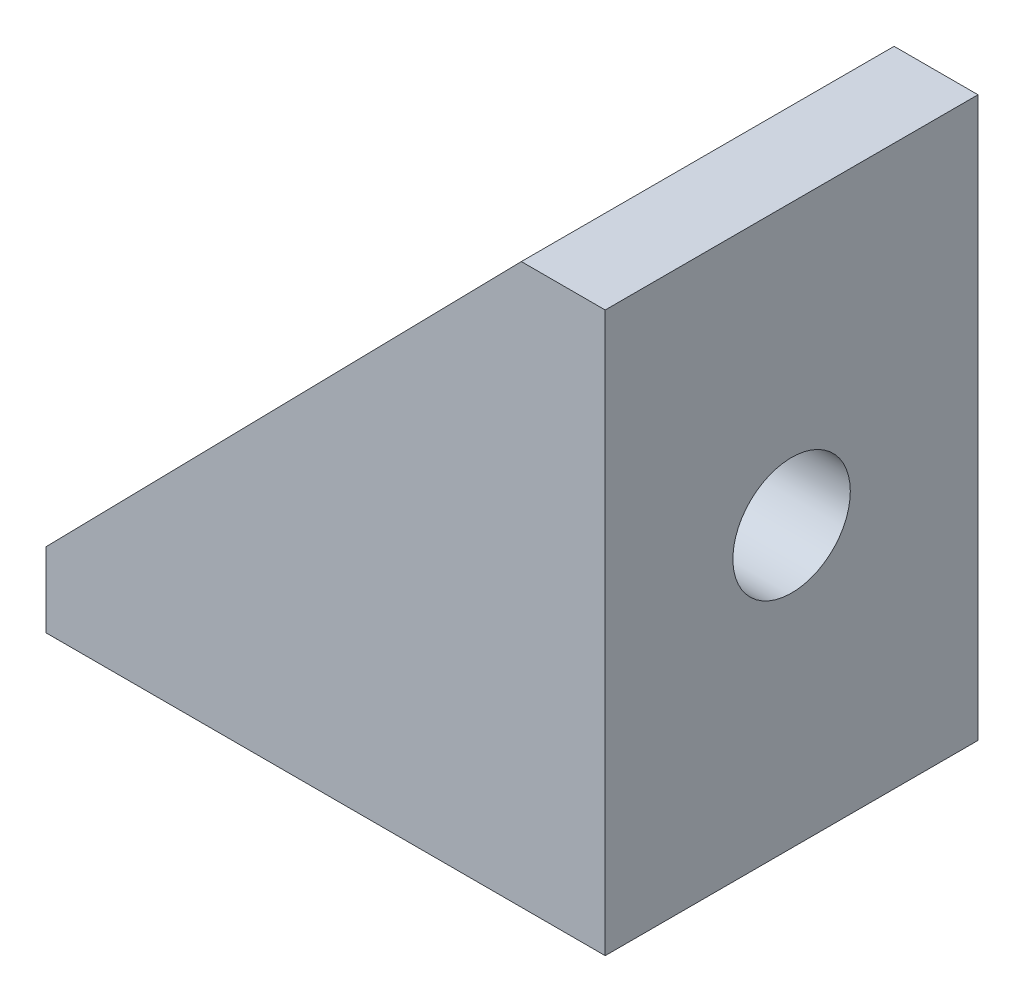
SolidWorks part; units mm, degrees
ref_plane "前视基准面" through (0, 0, 0) normal (0, 0, 1) x (1, 0, 0)
ref_plane "上视基准面" through (0, 0, 0) normal (0, 1, 0) x (1, 0, 0)
ref_plane "右视基准面" through (0, 0, 0) normal (1, 0, 0) x (0, 0, -1)
sketch "草图1" plane through (0, 0, 0) normal (0, 0, 1) x (1, 0, 0)
  line L0 (0, 0) -> (30, 0)
  line L1 (30, 0) -> (30, 30)
  line L2 (30, 30) -> (25.5, 30)
  line L3 (25.5, 30) -> (0, 4)
  line L4 (0, 4) -> (0, 0)
  dimension "D1" = 4.5
  dimension "D2" = 4
  dimension "D3" = 30
  dimension "D4" = 30
extrude "凸台-拉伸1" add sketch "草图1" along normal blind 20
sketch "草图2" plane through (0, 30, 0) normal (0, 1, 0) x (1, 0, 0)
  line L0 (25.5, -10) -> (9.5707, -10) construction
  line L1 (25.5, -20) -> (25.5, 0) construction
  line L2 (25.5, -20) -> (0, -20) construction
  line L3 (-6.3587, -3) -> (25.5, -3)
  line L4 (-6.3587, -3) -> (-6.3587, -17)
  line L5 (-6.3587, -17) -> (25.5, -17)
  line L6 (25.5, -3) -> (25.5, -17)
  line L7 (-6.3587, -3) -> (25.5, -17) construction
  line L8 (-6.3587, -17) -> (25.5, -3) construction
  dimension "D1" = 3
extrude "切除-拉伸1" cut sketch "草图2" against normal blind 26
sketch "草图3" plane through (30, 0, 0) normal (1, 0, 0) x (0, 0, -1)
  line L0 (-10, 0) -> (-10, 15) construction
  line L1 (-20, 0) -> (0, 0) construction
  circle A0 centre (-10, 15) radius 3.15
  dimension "D2" = 6.3
  dimension "D1" = 15
extrude "切除-拉伸2" cut sketch "草图3" against normal blind 26
sketch "草图4" plane through (0, 0, 0) normal (0, -1, 0) x (1, 0, 0)
  line L0 (30, 10) -> (12, 10) construction
  line L2 (30, 20) -> (30, 0) construction
  circle A0 centre (12, 10) radius 3.15
  dimension "D1" = 6.3
  dimension "D2" = 18
extrude "切除-拉伸3" cut sketch "草图4" against normal blind 26
